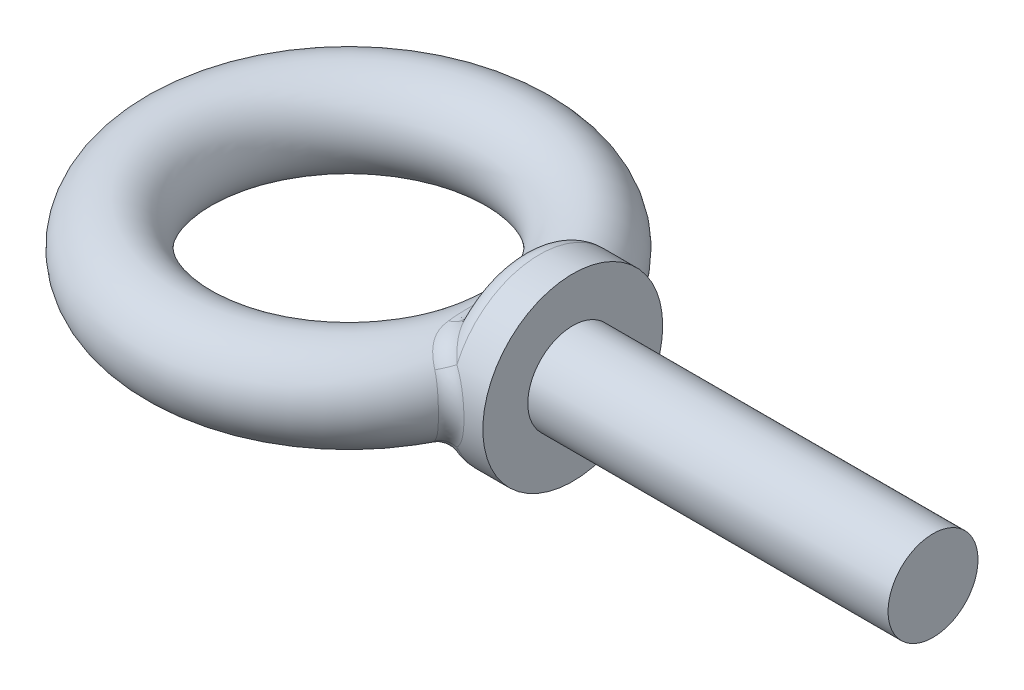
SolidWorks part; units mm, degrees
ref_plane "Front Plane" through (0, 0, 0) normal (0, 0, 1) x (1, 0, 0)
ref_plane "Top Plane" through (0, 0, 0) normal (0, 1, 0) x (1, 0, 0)
ref_plane "Right Plane" through (0, 0, 0) normal (1, 0, 0) x (0, 0, -1)
other "Configuration Table"
sketch "layout" plane through (0, 0, 0) normal (0, 1, 0) x (1, 0, 0)
  line L0 (0, 0) -> (41.275, 0) construction
  line L1 (-8.763, 0) -> (-15.113, 0) construction
  circle A0 centre (0, 0) radius 15.113 construction
  circle A1 centre (0, 0) radius 8.763 construction
sketch "Sketch2" plane through (0, 0, 0) normal (0, 0, 1) x (1, 0, 0)
  line L3 (0, 0) -> (0, 6.6909) construction
  line L4 (15.113, 0) -> (-15.113, 0) construction
  circle A0 centre (-11.938, 0) radius 3.175
  point P4 (-15.113, 0)
revolve "Revolve1" add sketch "Sketch2" angle 360 about L3
sketch "Sketch3" plane through (0, 0, 0) normal (0, 1, 0) x (1, 0, 0)
  line L0 (13.7142, 0) -> (13.7142, 6.35) construction
  line L1 (15.8372, 6.35) -> (15.8372, 3.175)
  line L2 (15.8372, 3.175) -> (41.275, 3.175)
  line L3 (41.275, 3.175) -> (41.275, 0)
  line L4 (0, 0) -> (59.9404, 0) construction
  line L5 (13.7142, 6.35) -> (15.8372, 6.35)
  line L6 (13.7142, 0) -> (8.763, 0) construction
  line L7 (0, 0) -> (41.275, 0) construction
  line L8 (11.2386, 0) -> (11.2386, -2.9252) construction
  line L9 (41.275, 0) -> (11.2386, 0)
  line L10 (14.7757, 3.175) -> (13.7142, 3.175) construction
  line L11 (12.9715, 17.6146) -> (15.0945, 17.6146) construction
  line L12 (15.0945, 17.6146) -> (12.9715, 18.6761) construction
  line L13 (12.6527, 6.35) -> (13.7142, 6.35)
  line L14 (12.9715, 18.1453) -> (14.033, 18.1453) construction
  line L15 (12.9715, 18.6761) -> (12.9715, 17.6146) construction
  line L16 (14.7757, 3.175) -> (15.8372, 3.175) construction
  circle A1 centre (0, 0) radius 15.113 construction
  arc A2 (12.6527, 6.35) -> (11.2386, 0) centre (26.2027, 0) ccw
  circle A4 centre (0, 0) radius 8.763 construction
revolve "Revolve2" add sketch "Sketch3" angle 360 about L9
fillet "Fillet1" radius 1.27 6 edges at (13.6966, -0.3584, -6.3399) (11.5928, -3.1584, -0.7057) (11.5928, 3.1584, 0.7057) (13.6966, 0.3584, 6.3399) (12.6527, -6.35, 0) (12.6527, 6.35, 0)
sketch "Sketch4" plane through (0, 0, 0) normal (0, 1, 0) x (1, 0, 0)
  line L0 (41.275, 2.3813) -> (41.7333, 3.175)
  line L1 (41.7333, 3.175) -> (41.7333, 4.0915)
  line L2 (41.7333, 4.0915) -> (40.8167, 4.0915)
  line L3 (40.8167, 4.0915) -> (40.8167, 3.175)
  line L4 (40.8167, 3.175) -> (41.275, 2.3813)
  line L5 (0, 0) -> (44.568, 0) construction
  line L6 (41.275, -3.175) -> (41.275, 3.175) construction
revolve "Cut-Revolve1" [suppressed] cut sketch "Sketch4" angle 360 about L5
pattern_linear "LPattern1" [suppressed] count 15 along (1, 0, 0)
equation "\"D1@Sketch2\" = \"DIA@layout\""
equation "\"D2@Sketch3\" = \"DIA@layout\""
equation "\"D1@Fillet1\" = \"DIA@layout\" / 5"
equation "\"D1@Sketch4\" = \"D2@Cosmetic Thread1\""
equation "\"D2@Sketch4\" = \"DIA@layout\""
equation "\"D1@LPattern1\" = \"D1@Cosmetic Thread1\" / \"P@LPattern1\""
